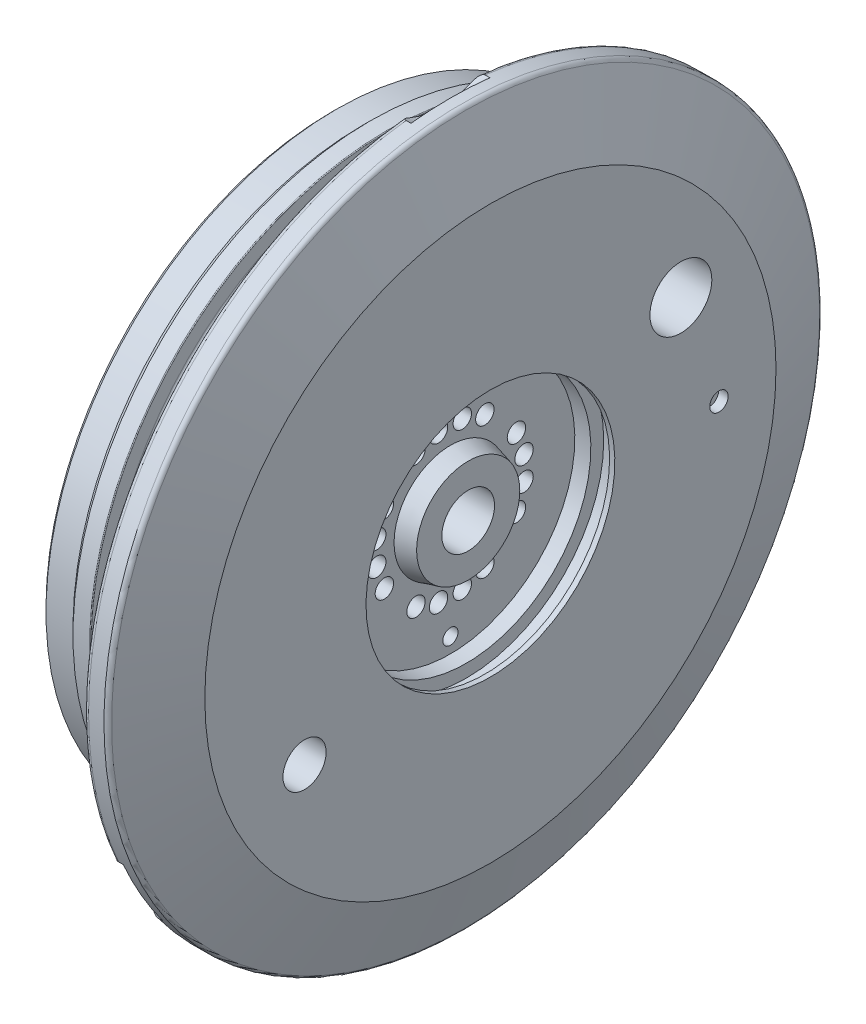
SolidWorks part; units mm, degrees
ref_plane "Front" through (0, 0, 0) normal (0, 0, 1) x (1, 0, 0)
ref_plane "Top" through (0, 0, 0) normal (0, 1, 0) x (1, 0, 0)
ref_plane "Right" through (0, 0, 0) normal (1, 0, 0) x (0, 0, -1)
sketch "Sketch1" plane through (0, 0, 0) normal (0, 0, 1) x (1, 0, 0)
  line L0 (0, 0) -> (-25.4, 0) construction
  line L1 (-25.4, 0) -> (-25.4, 46.482)
  line L2 (-25.4, 46.482) -> (-20.32, 46.482)
  line L3 (0, 0) -> (-25.4, 0)
  line L4 (-19.2405, 47.5615) -> (-16.4592, 47.5615)
  line L5 (-7.9248, 47.5615) -> (-7.9248, 57.15)
  line L6 (-7.9248, 57.15) -> (-4.1656, 57.15)
  line L7 (-4.1656, 57.15) -> (0, 45.7051)
  line L8 (0, 0) -> (0, 45.7051)
  line L10 (-11.1252, 44.7929) -> (-11.1252, 47.5615)
  line L11 (-16.4592, 44.7929) -> (-16.4592, 47.5615)
  line L13 (-11.1252, 44.7929) -> (-16.4592, 44.7929)
  line L14 (-11.1252, 47.5615) -> (-7.9248, 47.5615)
  line L15 (-20.32, 46.482) -> (-19.2405, 47.5615)
  dimension "D1" = 25.4
  dimension "D2" = 46.482
  dimension "D3" = 5.08
  dimension "D4" = 44.7929
  dimension "D5" = 14.2748
  dimension "D6" = 5.334
  dimension "D7" = 3.7592
  dimension "D8" = 20
revolve "Base-Revolve" add sketch "Sketch1" angle 360 about L0
sketch "Sketch2" plane through (-7.9248, 0, 0) normal (-1, 0, 0) x (0, 0, 1)
  circle A0 centre (0, 0) radius 50.8
  circle A1 centre (0, 0) radius 53.467
  dimension "D1" = 101.6
  dimension "D2" = 2.667
extrude "Cut-Extrude1" cut sketch "Sketch2" against normal blind 1.3208
chamfer "Chamfer1" distance 0.762 angle 45
fillet "Fillet1" radius 0.762
fillet "Fillet2" radius 0.381
fillet "Fillet3" radius 0.127
sketch "Sketch3" plane through (-7.9248, 0, 0) normal (-1, 0, 0) x (0, 0, 1)
  line L0 (62.3725, 0) -> (-71.3557, 0) construction
  line L2 (0, 0) -> (0, 71.5599) construction
  circle A0 centre (0, 67.818) radius 12.7
  circle A1 centre (58.7321, -33.909) radius 12.7
  circle A2 centre (-58.7321, -33.909) radius 12.7
  dimension "D2" = 25.4
extrude "Cut-Extrude2" cut sketch "Sketch3" against normal blind 1.524
sketch "Sketch4" plane through (0, 0, 0) normal (0, 0, 1) x (1, 0, 0)
  line L0 (0, 0) -> (-6.4008, 0) construction
  line L1 (-6.985, 0) -> (-7.7978, 0) construction
  line L2 (-6.4008, 0) -> (-6.4008, 19.9136) construction
  line L3 (-6.4008, 19.9136) -> (-3.8354, 19.9136)
  line L5 (-3.8354, 19.9136) -> (-3.8354, 21.971)
  line L6 (-3.8354, 21.971) -> (-0.8382, 21.971)
  line L7 (-0.8382, 21.971) -> (-0.8382, 19.9136)
  line L8 (-6.4008, 0) -> (-6.4008, 19.9136)
  line L9 (-0.8382, 19.9136) -> (2.0724, 19.9136)
  line L10 (-6.4008, 0) -> (3.2885, 0)
  line L11 (3.2885, 0) -> (2.0724, 19.9136)
  dimension "D1" = 6.4008
  dimension "D2" = 19.9136
  dimension "D3" = 2.5654
  dimension "D5" = 2.9972
revolve "Cut-Revolve1" cut sketch "Sketch4" angle 360 about L0
sketch "Sketch5" plane through (-6.4008, 0, 0) normal (1, 0, 0) x (0, 0, -1)
  line L0 (34.0956, 0) -> (-36.9539, 0) construction
  line L1 (0, -25.8269) -> (0, 33.5852) construction
  circle A0 centre (0, 17.4752) radius 1.2192
  circle A1 centre (0, -17.4752) radius 1.2192
  dimension "D1" = 17.4752
extrude "Cut-Extrude3" cut sketch "Sketch5" against normal blind 3.556
sketch "Sketch6" plane through (-6.4008, 0, 0) normal (1, 0, 0) x (0, 0, -1)
  circle A0 centre (0, 0) radius 4.2164
  dimension "D1" = 8.4328
extrude "Cut-Extrude5" cut sketch "Sketch6" against normal blind 4.7244
sketch "Sketch7" plane through (-6.4008, 0, 0) normal (1, 0, 0) x (0, 0, -1)
  line L0 (-21.797, 0) -> (27.779, 0) construction
  line L3 (0, 0) -> (0, 27.6855) construction
  circle A0 centre (5.5118, 10.541) radius 1.4732
  circle A1 centre (1.905, 11.7602) radius 1.4732
  circle A2 centre (-5.5118, 10.541) radius 1.4732
  circle A3 centre (-1.905, 11.7602) radius 1.4732
  circle A4 centre (10.5664, 5.4864) radius 1.4732
  circle A5 centre (11.7856, 1.8796) radius 1.4732
  circle A6 centre (11.7856, -1.9304) radius 1.4732
  circle A7 centre (10.5664, -5.5372) radius 1.4732
  circle A8 centre (5.5118, -10.5918) radius 1.4732
  circle A9 centre (1.905, -11.811) radius 1.4732
  circle A10 centre (-1.905, -11.811) radius 1.4732
  circle A11 centre (-5.5118, -10.5918) radius 1.4732
  circle A12 centre (-10.5664, -5.5372) radius 1.4732
  circle A13 centre (-11.7856, -1.9304) radius 1.4732
  circle A14 centre (-11.7856, 1.8796) radius 1.4732
  circle A15 centre (-10.5664, 5.4864) radius 1.4732
  dimension "D5" = 2.9464
  dimension "D3" = 1.905
  dimension "D2" = 11.7602
  dimension "D1" = 10.541
  dimension "D4" = 5.5118
extrude "Cut-Extrude6" cut sketch "Sketch7" against normal through all
sketch "Sketch8" plane through (-6.4008, 0, 0) normal (1, 0, 0) x (0, 0, -1)
  circle A0 centre (0, 0) radius 9.017
  circle A1 centre (0, 0) radius 4.2164
  dimension "D1" = 18.034
  dimension "D2" = 8.4328
extrude "Boss-Extrude1" add sketch "Sketch8" along normal blind 2.8448
chamfer "Chamfer2" distance 2.8448 angle 15
sketch "Sketch9" plane through (0, 0, 0) normal (1, 0, 0) x (0, 0, -1)
  line L0 (0, 0) -> (70.7432, 0) construction
  line L2 (0, 0) -> (0, 68.9057) construction
  circle A0 centre (30.48, 17.4752) radius 4.953
  dimension "D1" = 30.48
  dimension "D2" = 17.4752
extrude "Cut-Extrude7" cut sketch "Sketch9" against normal through all
sketch "Sketch10" plane through (0, 0, 0) normal (1, 0, 0) x (0, 0, -1)
  line L0 (0, 0) -> (36.576, 0) construction
  circle A0 centre (36.576, 0) radius 1.4732
  dimension "D2" = 2.9464
  dimension "D1" = 36.576
extrude "Cut-Extrude8" cut sketch "Sketch10" against normal blind 1.524
sketch "Sketch11" plane through (0, 0, 0) normal (1, 0, 0) x (0, 0, -1)
  line L0 (0, 0) -> (0, -65.6391) construction
  line L1 (0, 0) -> (-73.8057, 0) construction
  circle A0 centre (-29.7434, -17.1704) radius 3.4544
  dimension "D1" = 17.1704
  dimension "D2" = 29.7434
extrude "Cut-Extrude9" cut sketch "Sketch11" against normal through all
sketch "Sketch12" plane through (-25.4, 0, 0) normal (-1, 0, 0) x (0, 0, 1)
  line L0 (0, 0) -> (64.6183, 0) construction
  line L1 (0, 0) -> (0, -61.1475) construction
  circle A0 centre (29.7434, -17.1704) radius 4.2164
  dimension "D1" = 17.1704
  dimension "D2" = 29.7434
extrude "Cut-Extrude10" cut sketch "Sketch12" against normal blind 16.002
